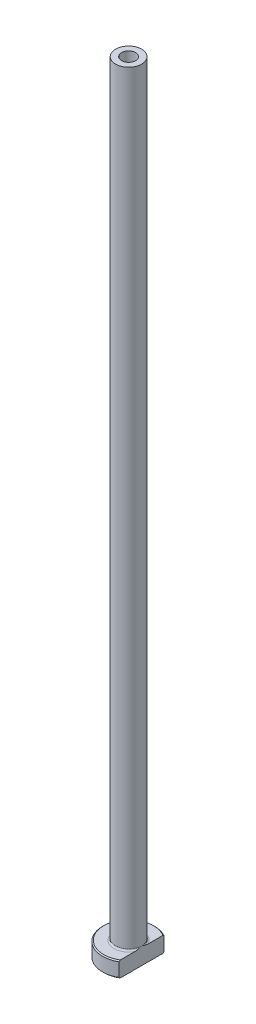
SolidWorks part; units mm, degrees
ref_plane "Front Plane" through (0, 0, 0) normal (0, 0, 1) x (1, 0, 0)
ref_plane "Top Plane" through (0, 0, 0) normal (0, 1, 0) x (1, 0, 0)
ref_plane "Right Plane" through (0, 0, 0) normal (1, 0, 0) x (0, 0, -1)
sketch "Sketch1" plane through (0, 0, 0) normal (0, 0, 1) x (1, 0, 0)
  line L0 (-1.35, 150) -> (-2.5, 150)
  line L1 (-2.5, 150) -> (-2.5, 3)
  line L2 (-2.5, 3) -> (-5, 3)
  line L3 (-5, 3) -> (-5, 0)
  line L4 (4.125, 0) -> (-4.125, 0) construction
  line L5 (-5, 0) -> (-1.6, 0)
  line L6 (-1.35, 105) -> (-1.35, 150)
  line L7 (0, 92.1877) -> (0, -15.5353) construction
  line L8 (0, -5.5) -> (0, 5.5) construction
  line L9 (-1.35, 105) -> (-1.6, 93)
  line L10 (-1.6, 93) -> (-1.6, 0)
  dimension "D1" = 0.25
  dimension "ID" = 2.7
  dimension "OD" = 5
  dimension "L" = 150
  dimension "H" = 10
  dimension "T" = 3
  dimension "N" = 45
  dimension "D2" = 12
  dimension "L-N" = 105
revolve "Revolve1" add sketch "Sketch1" angle 360 about L7
fillet "Fillet1" radius 0.3 1 edges at (0, 3, 2.5)
chamfer "Chamfer1" distance 0.2 angle 45 2 edges at (0, 3, 5) (0, 0, 5)
sketch "Sketch2" plane through (0, 0, 0) normal (0, -1, 0) x (1, 0, 0)
  line L0 (2.5, 4.3301) -> (2.5, -4.3301)
  circle A0 centre (0, 0) radius 5 construction
  arc A1 (2.5, 4.3301) -> (2.5, -4.3301) centre (0, 0) cw
  circle A2 centre (0, 0) radius 2.5 construction
extrude "Cut-Extrude1" cut sketch "Sketch2" against normal through all
chamfer "Chamfer2" distance 0.5 angle 45 1 edges at (0, 0, 1.6)
